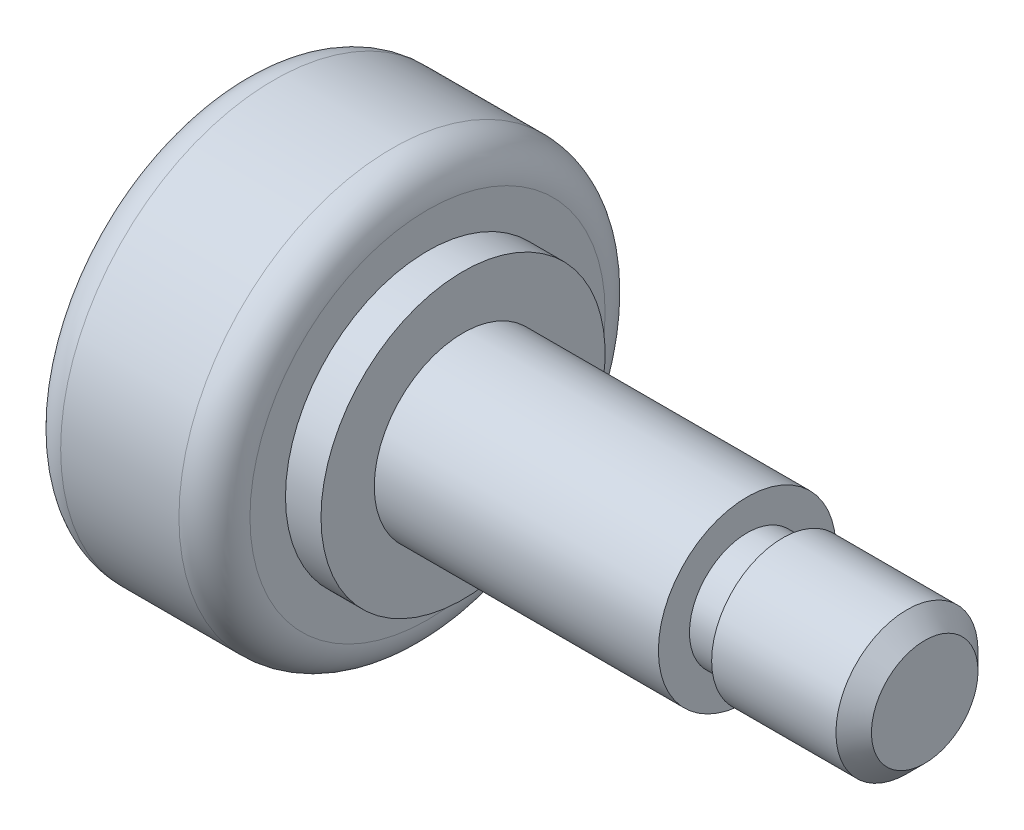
SolidWorks part; units mm, degrees
ref_plane "前视基准面" through (0, 0, 0) normal (0, 0, 1) x (1, 0, 0)
ref_plane "上视基准面" through (0, 0, 0) normal (0, 1, 0) x (1, 0, 0)
ref_plane "右视基准面" through (0, 0, 0) normal (1, 0, 0) x (0, 0, -1)
other "Configuration Table"
sketch "草图1" plane through (0, 0, 0) normal (0, 0, 1) x (1, 0, 0)
  line L0 (0, 0) -> (40, 0) construction
  line L1 (10, 12) -> (3.3394, 12)
  line L2 (12, 10) -> (12, 0)
  line L3 (14, 8) -> (14, 0)
  line L4 (14, 8) -> (12, 8)
  line L5 (14, 5) -> (30, 5)
  line L6 (30, 5) -> (30, 0)
  line L7 (30, 3.25) -> (32, 3.25)
  line L8 (32, 3.25) -> (32, 0)
  line L9 (40, 4) -> (32, 4)
  line L10 (32, 4) -> (32, 3.25)
  line L11 (40, 4) -> (40, 0)
  arc A0 (1.4099, 10.5263) -> (0, 0) centre (40, 0) ccw
  arc A1 (12, 10) -> (10, 12) centre (10, 10) ccw
  arc A2 (1.4099, 10.5263) -> (3.3394, 12) centre (3.3394, 10) cw
  dimension "D2" = 12
  dimension "D12" = 2
  dimension "D1" = 40
  dimension "D3" = 12
  dimension "D4" = 2
  dimension "D5" = 8
  dimension "D6" = 16
  dimension "D7" = 5
  dimension "D8" = 2
  dimension "D9" = 3.25
  dimension "D10" = 8
  dimension "D11" = 4
revolve "旋转1" add sketch "草图1" angle 360 about L0
chamfer "倒角1" distance 1 1 edges at (40, 0, 4)
